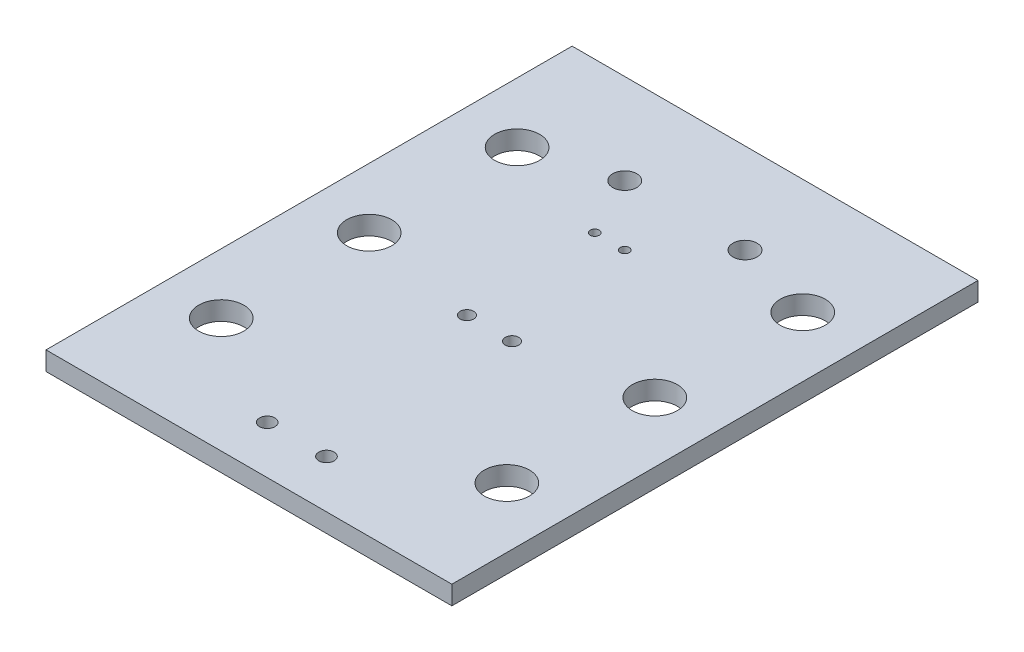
SolidWorks part; units mm, degrees
ref_plane "Front Plane" through (0, 0, 0) normal (0, 0, 1) x (1, 0, 0)
ref_plane "Top Plane" through (0, 0, 0) normal (0, 1, 0) x (1, 0, 0)
ref_plane "Right Plane" through (0, 0, 0) normal (1, 0, 0) x (0, 0, -1)
sketch "Sketch1" plane through (0, 0, 0) normal (0, 1, 0) x (1, 0, 0)
  line L1 (-17.145, 44.45) -> (17.145, 44.45)
  line L2 (-17.145, 44.45) -> (-17.145, 0)
  line L3 (-17.145, 0) -> (17.145, 0)
  line L4 (17.145, 44.45) -> (17.145, 0)
  point P4 (0, 0)
  dimension "D1" = 34.29
  dimension "D2" = 44.45
extrude "Boss-Extrude1" add sketch "Sketch1" along normal blind 1.5875
sketch "Sketch2"
  line L0 (0, 0) -> (0, 44.45) construction
  line L1 (-17.145, 0) -> (17.145, 0) construction
  line L2 (17.145, 44.45) -> (-17.145, 44.45) construction
  circle A0 centre (12.065, 34.7218) radius 1.905
  circle A1 centre (12.065, 22.225) radius 1.905
  circle A2 centre (12.065, 9.7257) radius 1.905
  circle A3 centre (2.5019, 4.0488) radius 0.6477
  circle A4 centre (1.905, 20.32) radius 0.5715
  circle A5 centre (0, 31.75) radius 0.381
  circle A6 centre (-2.54, 31.75) radius 0.381
  circle A7 centre (5.08, 36.83) radius 1.016
  circle A8 centre (-12.065, 9.7257) radius 1.905
  circle A9 centre (-2.5019, 4.0488) radius 0.6477
  circle A10 centre (-12.065, 22.225) radius 1.905
  circle A11 centre (-1.905, 20.32) radius 0.5715
  circle A12 centre (-12.065, 34.7218) radius 1.905
  circle A13 centre (-5.08, 36.83) radius 1.016
other "AlignGroup1" parameters "D1"=3.1238, "D17"=1.1364, "D18"=1.1979, "D19"=1.1436, "D20"=2.0932, "D12"=1.2954, "D2"=44.45, "D3"=34.29, "D4"=9.7257, "D5"=22.225, "D6"=34.7218, "D7"=4.0488, "D8"=20.32, "D9"=31.75, "D10"=36.83, "D11"=0, "D13"=12.065, "D14"=1.905, "D15"=2.54, "D16"=5.08
other "AlignGroup2"
other "AlignGroup3"
extrude "Cut-Extrude1" cut sketch "Sketch2" against normal through all
